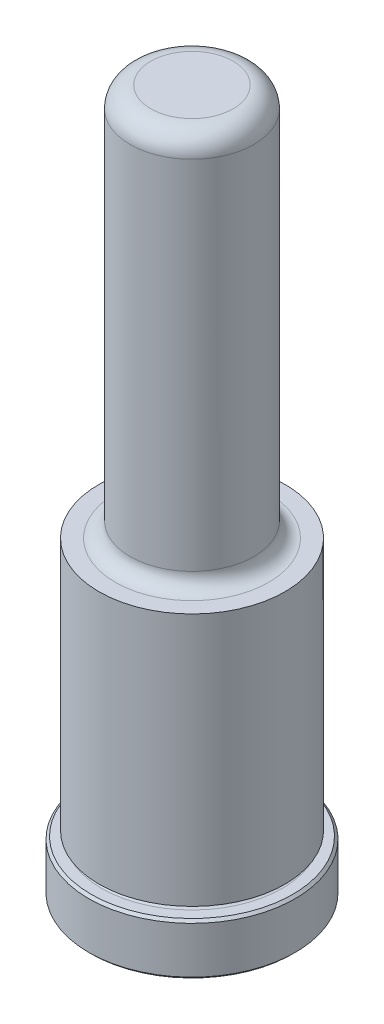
SolidWorks part; units mm, degrees
ref_plane "Front Plane" through (0, 0, 0) normal (0, 0, 1) x (1, 0, 0)
ref_plane "Top Plane" through (0, 0, 0) normal (0, 1, 0) x (1, 0, 0)
ref_plane "Right Plane" through (0, 0, 0) normal (1, 0, 0) x (0, 0, -1)
sketch "Sketch1" plane through (0, 0, 0) normal (1, 0, 0) x (0, 0, -1)
  line L0 (0, 0) -> (15.875, 0)
  line L1 (15.875, 0) -> (15.875, 7.9248)
  line L2 (15.875, 7.9248) -> (13.8938, 7.9248)
  line L3 (13.5128, 2.6782) -> (13.5128, 5.9795) construction
  line L4 (13.8938, 8.6868) -> (14.3002, 8.6868)
  line L5 (14.3002, 8.6868) -> (14.3002, 47.625)
  line L6 (14.3002, 47.625) -> (11.7983, 47.625)
  line L7 (9.5123, 49.911) -> (9.5123, 107.95)
  line L9 (9.5123, 107.95) -> (0, 107.95)
  line L10 (0, 107.95) -> (0, 0)
  line L11 (0, 0) -> (0, -7.2694) construction
  arc A0 (13.8938, 8.6868) -> (13.8938, 7.9248) centre (13.8938, 8.3058) ccw
  arc A1 (11.7983, 47.625) -> (9.5123, 49.911) centre (11.7983, 49.911) cw
  point P2 (9.5123, 107.95)
  point P14 (9.5123, 107.8137)
  point P19 (9.5123, 47.625)
  dimension "D14" = 0.762
  dimension "D8" = 2.286
  dimension "T" = 7.9248
  dimension "D2" = 0.762
  dimension "M" = 31.75
  dimension "B" = 28.6004
  dimension "L" = 107.95
  dimension "D7" = 0.7874
  dimension "A" = 47.625
  dimension "D" = 19.0246
  dimension "D15" = 60.325
revolve "Revolve1" add sketch "Sketch1" angle 360 about L11
chamfer "Chamfer1" distance 0.381 angle 45 2 edges at (0, 0, 15.875) (0, 7.9248, 15.875)
fillet "Fillet1" radius 3.175 1 edges at (0, 107.95, 9.5123)
